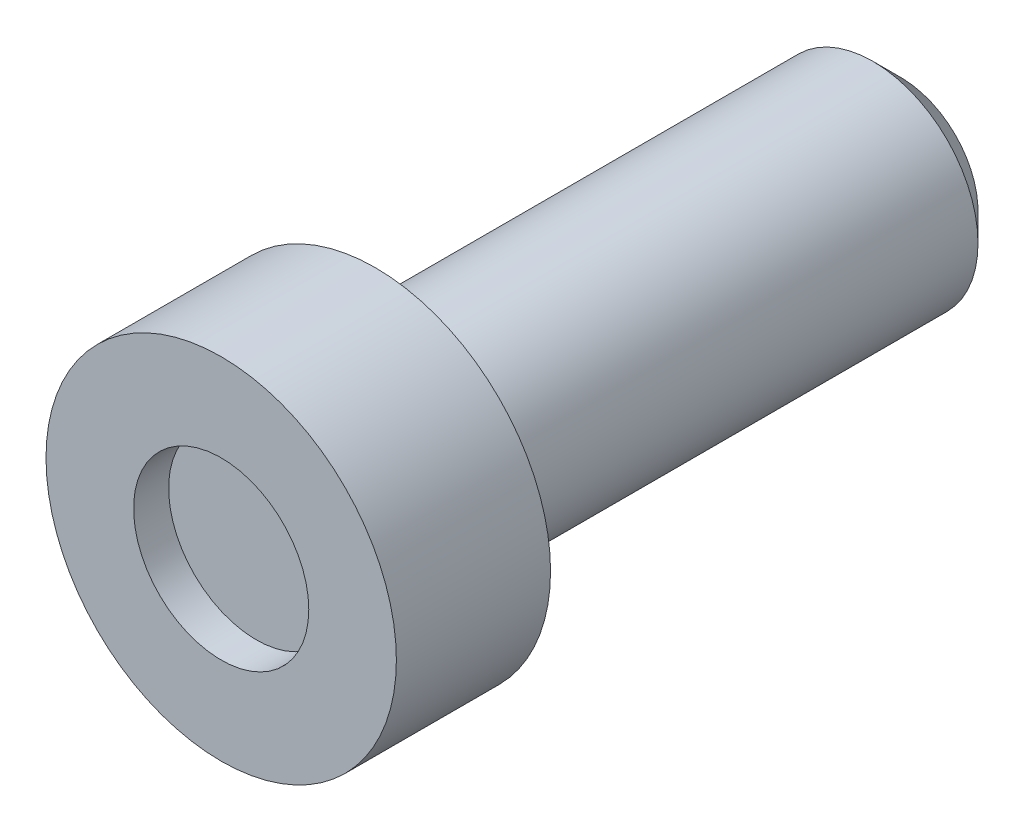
SolidWorks part; units mm, degrees
ref_plane "Face" through (0, 0, 0) normal (0, 0, 1) x (1, 0, 0)
ref_plane "Dessus" through (0, 0, 0) normal (0, 1, 0) x (1, 0, 0)
ref_plane "Droite" through (0, 0, 0) normal (1, 0, 0) x (0, 0, -1)
sketch "Esquisse1" plane through (0, 0, 0) normal (0, 0, 1) x (1, 0, 0)
  circle A0 centre (0, 0) radius 25
  dimension "D1" = 50
extrude "Base-Extrusion" add sketch "Esquisse1" along normal blind 22
sketch "Esquisse2" plane through (0, 0, 22) normal (0, 0, 1) x (1, 0, 0)
  circle A0 centre (0, 0) radius 12.5
  circle A1 centre (0, 0) radius 25 construction
  dimension "D1" = 25
extrude "Enlèv. mat.-Extru.1" cut sketch "Esquisse2" against normal blind 5
sketch "Esquisse3" plane through (0, 0, 0) normal (0, 0, -1) x (-1, 0, 0)
  circle A0 centre (0, 0) radius 15
  dimension "D1" = 30
extrude "Boss.-Extru.1" add sketch "Esquisse3" along normal blind 75
chamfer "Chanfrein1" distance 4 angle 45 1 edges at (-15, 0, -75)
